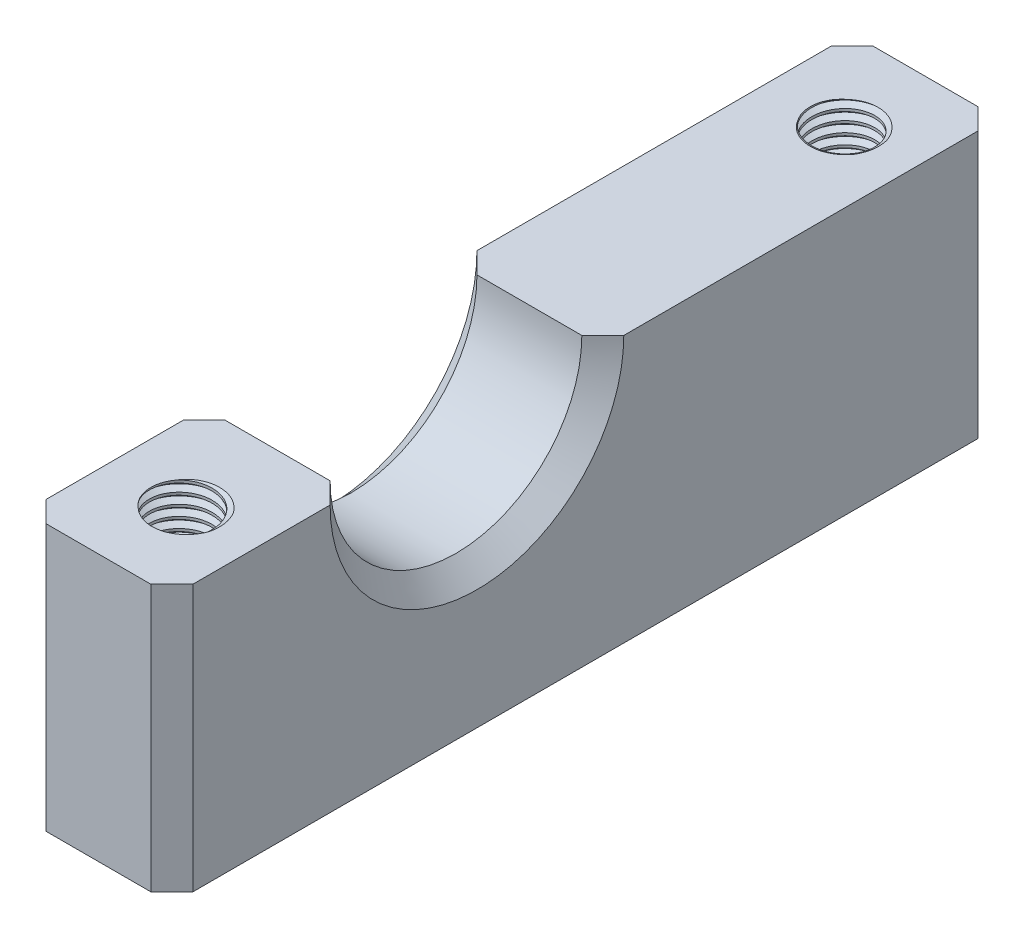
SolidWorks part; units mm, degrees
ref_plane "Front Plane" through (0, 0, 0) normal (0, 0, 1) x (1, 0, 0)
ref_plane "Top Plane" through (0, 0, 0) normal (0, 1, 0) x (1, 0, 0)
ref_plane "Right Plane" through (0, 0, 0) normal (1, 0, 0) x (0, 0, -1)
sketch "Sketch1" plane through (0, 0, 0) normal (1, 0, 0) x (0, 0, -1)
  line L0 (-17.272, 0) -> (-6.6322, 0)
  line L1 (17.1793, -12.7) -> (-17.272, -12.7)
  line L2 (17.1793, -12.7) -> (17.1793, 0)
  line L3 (-17.272, -12.7) -> (-17.272, 0)
  line L4 (-17.272, -12.7) -> (26.154, -12.7)
  line L5 (6.6322, 0) -> (17.1793, 0)
  line L6 (26.154, -12.7) -> (26.154, 0)
  line L7 (6.6322, 0) -> (26.154, 0)
  line L8 (-13.272, -12.7) -> (-13.272, 0)
  line L9 (-6.6322, 0) -> (-4.73, 0)
  arc A0 (-6.6322, 0) -> (6.6322, 0) centre (0, 0) ccw
  circle A1 centre (1.27, 0) radius 6
  dimension "D2" = 6.6322
  dimension "D7" = 12
  dimension "D1" = 12.7
  dimension "D3" = 17.1793
  dimension "D4" = 26.154
  dimension "D5" = 17.272
  dimension "D6" = 4
  dimension "D8" = 1.27
extrude "Boss-Extrude1" add sketch "Sketch1" along normal blind 7 contours A0 L0 L3 L1 L2 L5 | L7 L2 L4 L6 | A1 L9 A0
sketch "Sketch2" plane through (0, -12.7, 0) normal (0, -1, 0) x (1, 0, 0)
  line L4 (0, 13.272) -> (0, -26.154)
  line L5 (0, -26.154) -> (7, -26.154)
  line L6 (7, -26.154) -> (7, 13.272)
  line L7 (7, 13.272) -> (0, 13.272)
  line L8 (0, 13.272) -> (0, -26.154) construction
  line L9 (0, -26.154) -> (7, -26.154) construction
  line L10 (7, -26.154) -> (7, 13.272) construction
  line L12 (7, 13.272) -> (0, 13.272)
  circle A0 centre (3.5, 9.272) radius 1.5
  point P6 (3.5, 9.2895)
  dimension "D2" = 3
  dimension "D3" = 4
  dimension "D4" = 3.5
  dimension "D1" = 0
extrude "Cut-Extrude1" cut sketch "Sketch2" against normal through all contours A0
thread "Thread1" pitch 0.5 start angle 0, offset 1, length 0, pitch 0.5, diameter 3
ref_plane "Plane1" through (5, -13.7, 9.272) normal (0, 0, 1) x (1, 0, 0)
sketch "Thread Profile1" plane through (5, -13.7, 9.272) normal (0, 0, 1) x (1, 0, 0)
  line L0 (0, 0) -> (0, 0.5) construction
  line L1 (0, 0) -> (0.2706, 0.1562)
  line L2 (0.2706, 0.1562) -> (0.2706, 0.2187)
  line L3 (0.2706, 0.2187) -> (0, 0.375)
  line L4 (0.2706, 0.1875) -> (0, 0.1875) construction
  line L11 (0, 0) -> (0, 0.375)
  point P2 (0, 0)
  dimension "Pitch" = 0.5
  dimension "Profile_Angle" = 60
  dimension "Profile_Land" = 0.0625
  dimension "Profile_Height" = 0.2706
ref_plane "Plane2" through (0, 0, -6.441) normal (0, 0, 1) x (1, 0, 0)
mirror "Mirror1" about plane through (0, 0, -6.441) normal (0, 0, 1) of "Thread1", "Cut-Extrude1"
chamfer "Chamfer1" distance 1 angle 45 6 edges at (0, -6.35, -26.154) (7, -6.35, -26.154) (0, -6.35, 13.272) (7, -6.35, 13.272) (0, -6, -1.27) (7, -6, -1.27)
